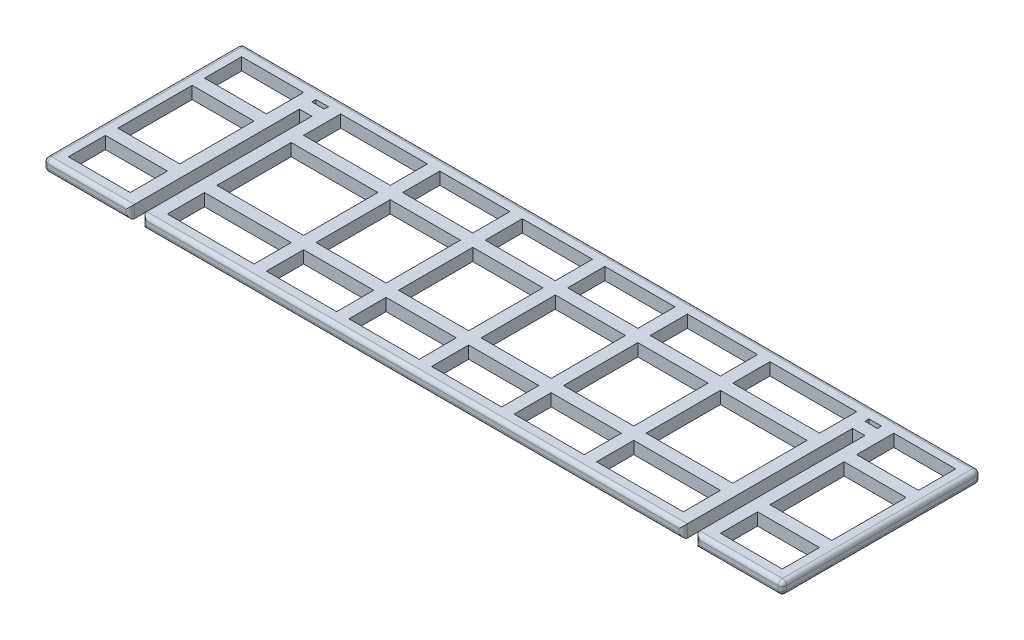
SolidWorks part; units mm, degrees
ref_plane "Front Plane" through (0, 0, 0) normal (0, 0, 1) x (1, 0, 0)
ref_plane "Top Plane" through (0, 0, 0) normal (0, 1, 0) x (1, 0, 0)
ref_plane "Right Plane" through (0, 0, 0) normal (1, 0, 0) x (0, 0, -1)
sketch "Sketch1" plane through (0, 0, 0) normal (1, 0, 0) x (0, 0, -1)
  line L1 (0, 4.7625) -> (76.2, 4.7625)
  line L2 (76.2, 4.7625) -> (76.2, 0)
  line L4 (0, 4.7625) -> (0, 0)
  line L5 (0, 0) -> (76.2, 0)
  dimension "D1" = 4.7625
  dimension "D2" = 76.2
extrude "Boss-Extrude1" add sketch "Sketch1" along normal blind 284.1625
sketch "Sketch2" plane through (0, 4.7625, 0) normal (0, 1, 0) x (1, 0, 0)
  line L28 (279.4, 4.7625) -> (279.4, 71.4375)
  line L29 (4.7625, 4.7625) -> (279.4, 4.7625)
  line L30 (279.4, 71.4375) -> (4.7625, 71.4375)
  line L31 (4.7625, 71.4375) -> (4.7625, 4.7625)
  line L32 (279.4, 4.7625) -> (279.4, 71.4375)
  line L33 (4.7625, 4.7625) -> (279.4, 4.7625)
  line L34 (279.4, 71.4375) -> (4.7625, 71.4375)
  line L35 (4.7625, 71.4375) -> (4.7625, 4.7625)
  dimension "D1" = 4.7625
extrude "Cut-Extrude1" cut sketch "Sketch2" against normal through all both and the other way through all
sketch "Sketch3" plane through (0, 0, -4.7625) normal (0, 0, -1) x (-1, 0, 0)
  line L0 (-4.7625, 0) -> (-279.4, 0) construction
  line L1 (-38.1, 0) -> (-42.8625, 0)
  line L2 (-38.1, 0) -> (-38.1, 4.7625)
  line L3 (-38.1, 4.7625) -> (-42.8625, 4.7625)
  line L4 (-42.8625, 0) -> (-42.8625, 4.7625)
  line L5 (-279.4, 4.7625) -> (-4.7625, 4.7625) construction
  line L6 (0, 4.7625) -> (0, 0) construction
  line L8 (-33.3375, 4.7625) -> (-28.575, 4.7625)
  line L9 (-33.3375, 4.7625) -> (-33.3375, 0)
  line L10 (-33.3375, 0) -> (-28.575, 0)
  line L11 (-28.575, 4.7625) -> (-28.575, 0)
  dimension "D1" = 4.7625
  dimension "D2" = 38.1
  dimension "D3" = 4.7625
  dimension "D4" = 4.7625
extrude "Boss-Extrude2" add sketch "Sketch3" along normal blind 65.0875
sketch "Sketch5" plane through (33.3375, 0, 0) normal (1, 0, 0) x (0, 0, -1)
  line L0 (69.85, 0) -> (4.7625, 0) construction
  line L1 (69.85, 4.7625) -> (65.0875, 4.7625)
  line L2 (69.85, 4.7625) -> (69.85, 0)
  line L3 (69.85, 0) -> (65.0875, 0)
  line L4 (65.0875, 4.7625) -> (65.0875, 0)
  dimension "D1" = 4.7625
extrude "Boss-Extrude3" add sketch "Sketch5" along normal up to surface (4.7625 mm away)
sketch "Sketch8" plane through (0, 0, -71.4375) normal (0, 0, 1) x (1, 0, 0)
  line L4 (33.3375, 4.7625) -> (28.575, 4.7625)
  line L5 (28.575, 4.7625) -> (28.575, 0)
  line L6 (28.575, 0) -> (33.3375, 0)
  line L7 (33.3375, 0) -> (33.3375, 4.7625)
  line L8 (33.3375, 4.7625) -> (28.575, 4.7625)
  line L9 (28.575, 4.7625) -> (28.575, 0)
  line L10 (28.575, 0) -> (33.3375, 0)
  line L11 (33.3375, 0) -> (33.3375, 4.7625)
  line L12 (38.1, 0) -> (42.8625, 0)
  line L13 (42.8625, 0) -> (42.8625, 4.7625)
  line L14 (42.8625, 4.7625) -> (38.1, 4.7625)
  line L15 (38.1, 4.7625) -> (38.1, 0)
  line L16 (38.1, 0) -> (42.8625, 0)
  line L17 (42.8625, 0) -> (42.8625, 4.7625)
  line L18 (42.8625, 4.7625) -> (38.1, 4.7625)
  line L19 (38.1, 4.7625) -> (38.1, 0)
  dimension "D1" = 0
  dimension "D2" = 0
extrude "Boss-Extrude4" add sketch "Sketch8" along normal up to surface (1.5875 mm away)
ref_plane "Plane1" through (142.0812, 0, 0) normal (-1, 0, 0) x (0, 0, 1)
mirror "Mirror1" about plane through (142.0812, 0, 0) normal (-1, 0, 0) of "Boss-Extrude4", "Boss-Extrude3", "Boss-Extrude2"
sketch "Sketch9" plane through (0, 0, 0) normal (0, 0, 1) x (1, 0, 0)
  line L0 (38.1, 4.7625) -> (33.3375, 4.7625) construction
  line L1 (33.3375, 0) -> (38.1, 0) construction
  line L2 (38.1, 0) -> (38.1, 4.7625) construction
  line L3 (33.3375, 4.7625) -> (33.3375, 0) construction
  line L4 (38.1, 4.7625) -> (33.3375, 4.7625)
  line L5 (33.3375, 0) -> (38.1, 0)
  line L6 (38.1, 0) -> (38.1, 4.7625)
  line L7 (33.3375, 4.7625) -> (33.3375, 0)
  line L8 (246.0625, 0) -> (246.0625, 4.7625) construction
  line L9 (250.825, 4.7625) -> (250.825, 0) construction
  line L10 (246.0625, 0) -> (250.825, 0) construction
  line L11 (250.825, 4.7625) -> (246.0625, 4.7625) construction
  line L12 (246.0625, 0) -> (246.0625, 4.7625)
  line L13 (250.825, 4.7625) -> (250.825, 0)
  line L14 (246.0625, 0) -> (250.825, 0)
  line L15 (250.825, 4.7625) -> (246.0625, 4.7625)
extrude "Cut-Extrude2" cut sketch "Sketch9" against normal up to surface (4.7625 mm away)
sketch "Sketch10" plane through (42.8625, 0, 0) normal (1, 0, 0) x (0, 0, -1)
  line L0 (38.1, 4.7625) -> (38.1, 0) construction
  line L1 (71.4375, 4.7625) -> (4.7625, 4.7625) construction
  line L2 (71.4375, 0) -> (4.7625, 0) construction
  line L3 (21.4312, 4.7625) -> (21.4312, 0) construction
  line L4 (19.05, 4.7625) -> (23.8125, 4.7625)
  line L5 (19.05, 4.7625) -> (19.05, 0)
  line L6 (19.05, 0) -> (23.8125, 0)
  line L7 (23.8125, 4.7625) -> (23.8125, 0)
  line L8 (52.3875, 4.7625) -> (57.15, 4.7625)
  line L9 (52.3875, 4.7625) -> (52.3875, 0)
  line L10 (52.3875, 0) -> (57.15, 0)
  line L11 (57.15, 4.7625) -> (57.15, 0)
  line L12 (54.7688, 4.7625) -> (54.7688, 0) construction
  line L13 (4.7625, 2.3812) -> (38.1, 2.3812) construction
  line L14 (4.7625, 4.7625) -> (4.7625, 0) construction
  line L15 (38.1, 2.3812) -> (71.4375, 2.3812) construction
  line L16 (71.4375, 0) -> (71.4375, 4.7625) construction
  point P18 (21.4312, 2.3812)
  point P23 (21.4313, 2.3812)
  point P24 (54.7688, 2.3812)
  point P28 (54.7688, 2.3812)
  dimension "D1" = 4.7625
  dimension "D2" = 4.7625
extrude "Boss-Extrude5" add sketch "Sketch10" along normal up to surface (198.4375 mm away)
sketch "Sketch11" plane through (0, 0, -4.7625) normal (0, 0, -1) x (-1, 0, 0)
  line L0 (-241.3, 4.7625) -> (-42.8625, 4.7625) construction
  line L1 (-144.4625, 4.7625) -> (-139.7, 4.7625)
  line L2 (-144.4625, 4.7625) -> (-144.4625, 0)
  line L3 (-144.4625, 0) -> (-139.7, 0)
  line L4 (-139.7, 4.7625) -> (-139.7, 0)
  line L5 (-42.8625, 0) -> (-241.3, 0) construction
  line L6 (-112.7125, 4.7625) -> (-112.7125, 0)
  line L7 (-112.7125, 4.7625) -> (-107.95, 4.7625)
  line L8 (-112.7125, 0) -> (-107.95, 0)
  line L9 (-107.95, 4.7625) -> (-107.95, 0)
  line L10 (-80.9625, 4.7625) -> (-80.9625, 0)
  line L11 (-80.9625, 4.7625) -> (-76.2, 4.7625)
  line L12 (-80.9625, 0) -> (-76.2, 0)
  line L13 (-76.2, 4.7625) -> (-76.2, 0)
  line L14 (-144.4625, 4.7625) -> (-112.7125, 4.7625) construction
  line L15 (-176.2125, 4.7625) -> (-171.45, 4.7625)
  line L16 (-171.45, 4.7625) -> (-171.45, 0)
  line L17 (-176.2125, 4.7625) -> (-176.2125, 0)
  line L18 (-207.9625, 4.7625) -> (-203.2, 4.7625)
  line L19 (-203.2, 4.7625) -> (-203.2, 0)
  line L20 (-207.9625, 4.7625) -> (-207.9625, 0)
  line L21 (-144.4625, 4.7625) -> (-176.2125, 4.7625) construction
  line L22 (-207.9625, 0) -> (-203.2, 0)
  line L23 (-176.2125, 0) -> (-171.45, 0)
  point P8 (-142.0812, 4.7625)
  point P9 (-142.0812, 4.7625)
  dimension "D1" = 4.7625
  dimension "D3" = 31.75
  dimension "D5" = 31.75
  dimension "D2" = 3
  dimension "D4" = 3
extrude "Boss-Extrude6" add sketch "Sketch11" along normal up to surface (66.675 mm away)
sketch "Sketch12" plane through (255.5875, 0, 0) normal (1, 0, 0) x (0, 0, -1)
  line L4 (57.15, 4.7625) -> (52.3875, 4.7625)
  line L5 (57.15, 0) -> (57.15, 4.7625)
  line L6 (52.3875, 0) -> (57.15, 0)
  line L7 (52.3875, 4.7625) -> (52.3875, 0)
  line L8 (57.15, 4.7625) -> (52.3875, 4.7625)
  line L9 (57.15, 0) -> (57.15, 4.7625)
  line L10 (52.3875, 0) -> (57.15, 0)
  line L11 (52.3875, 4.7625) -> (52.3875, 0)
  line L12 (23.8125, 4.7625) -> (19.05, 4.7625)
  line L13 (23.8125, 0) -> (23.8125, 4.7625)
  line L14 (19.05, 0) -> (23.8125, 0)
  line L15 (19.05, 4.7625) -> (19.05, 0)
  line L16 (23.8125, 4.7625) -> (19.05, 4.7625)
  line L17 (23.8125, 0) -> (23.8125, 4.7625)
  line L18 (19.05, 0) -> (23.8125, 0)
  line L19 (19.05, 4.7625) -> (19.05, 0)
  dimension "D1" = 0
  dimension "D2" = 0
extrude "Boss-Extrude7" add sketch "Sketch12" along normal up to surface (23.8125 mm away)
sketch "Sketch13" plane through (28.575, 0, 0) normal (-1, 0, 0) x (0, 0, 1)
  line L4 (-52.3875, 4.7625) -> (-57.15, 4.7625)
  line L5 (-57.15, 4.7625) -> (-57.15, 0)
  line L6 (-57.15, 0) -> (-52.3875, 0)
  line L7 (-52.3875, 0) -> (-52.3875, 4.7625)
  line L8 (-52.3875, 4.7625) -> (-57.15, 4.7625)
  line L9 (-57.15, 4.7625) -> (-57.15, 0)
  line L10 (-57.15, 0) -> (-52.3875, 0)
  line L11 (-52.3875, 0) -> (-52.3875, 4.7625)
  line L12 (-19.05, 4.7625) -> (-23.8125, 4.7625)
  line L13 (-23.8125, 4.7625) -> (-23.8125, 0)
  line L14 (-23.8125, 0) -> (-19.05, 0)
  line L15 (-19.05, 0) -> (-19.05, 4.7625)
  line L16 (-19.05, 4.7625) -> (-23.8125, 4.7625)
  line L17 (-23.8125, 4.7625) -> (-23.8125, 0)
  line L18 (-23.8125, 0) -> (-19.05, 0)
  line L19 (-19.05, 0) -> (-19.05, 4.7625)
  dimension "D1" = 0
  dimension "D2" = 0
extrude "Boss-Extrude8" add sketch "Sketch13" along normal up to surface (23.8125 mm away)
fillet "Fillet1" radius 1.5875 20 edges at (0, 2.3813, 0) (0, 0, -38.1) (0, 4.7625, -38.1) (0, 2.3813, -76.2) (142.0812, 0, -76.2) (142.0812, 4.7625, -76.2) (284.1625, 2.3813, -76.2) (284.1625, 0, -38.1) (284.1625, 4.7625, -38.1) (284.1625, 2.3813, 0) (267.4937, 0, 0) (267.4937, 4.7625, 0) (250.825, 2.3813, 0) (33.3375, 2.3813, 0) (38.1, 2.3813, 0) (246.0625, 2.3813, 0) (142.0813, 0, 0) (16.6687, 0, 0) (16.6688, 4.7625, 0) (142.0812, 4.7625, 0)
